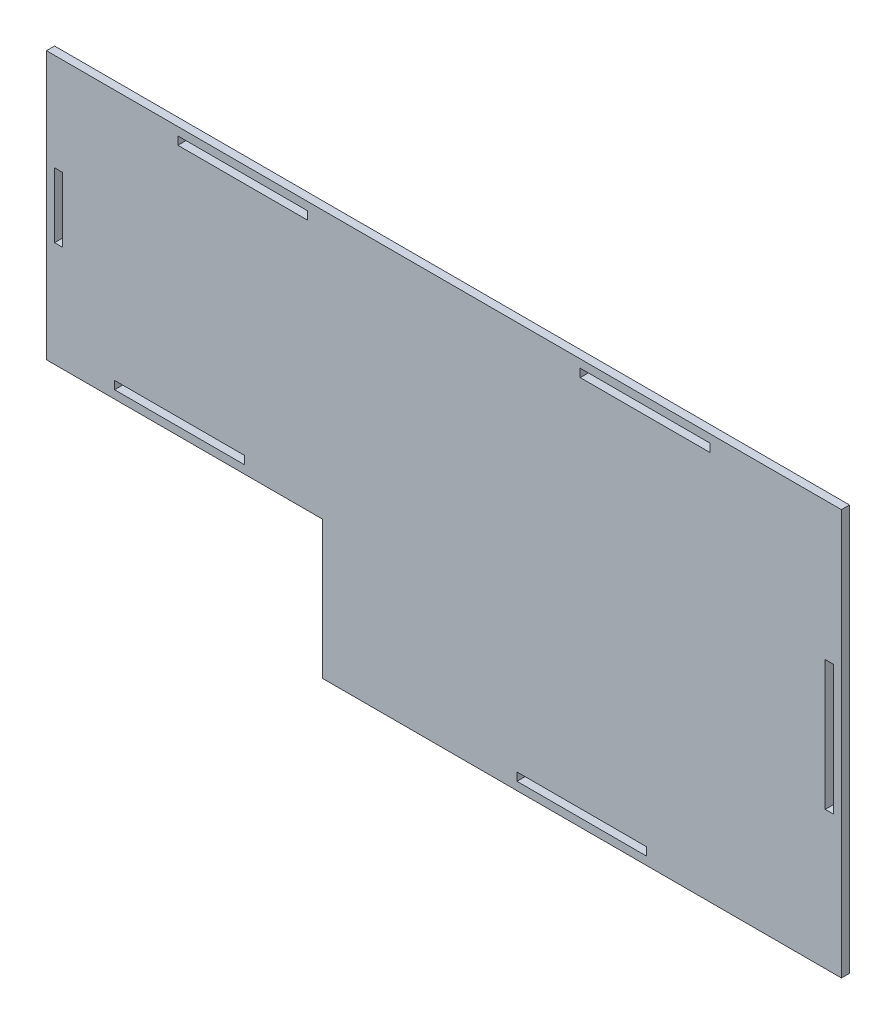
SolidWorks part; units mm, degrees
ref_plane "Front Plane" through (0, 0, 0) normal (0, 0, 1) x (1, 0, 0)
ref_plane "Top Plane" through (0, 0, 0) normal (0, 1, 0) x (1, 0, 0)
ref_plane "Right Plane" through (0, 0, 0) normal (1, 0, 0) x (0, 0, -1)
sketch "Sketch1" plane through (0, 0, 0) normal (0, 0, 1) x (1, 0, 0)
  line L0 (-87.3348, 2.7523) -> (-87.3348, -51.2227)
  line L1 (-87.3348, 2.7523) -> (-195.2848, 2.7523)
  line L2 (-87.3348, -51.2227) -> (115.8652, -51.2227)
  line L3 (-195.2848, 2.7523) -> (-195.2848, 107.5273)
  line L4 (-195.2848, 107.5273) -> (115.8652, 107.5273)
  line L5 (115.8652, 107.5273) -> (115.8652, -51.2227)
  line L7 (-168.6148, 5.9273) -> (-117.8148, 5.9273)
  line L8 (-168.6148, 5.9273) -> (-168.6148, 9.1023)
  line L9 (-168.6148, 9.1023) -> (-117.8148, 9.1023)
  line L10 (-117.8148, 5.9273) -> (-117.8148, 9.1023)
  line L11 (-192.1098, 69.4273) -> (-188.9348, 69.4273)
  line L12 (-192.1098, 69.4273) -> (-192.1098, 44.0273)
  line L13 (-192.1098, 44.0273) -> (-188.9348, 44.0273)
  line L14 (-188.9348, 69.4273) -> (-188.9348, 44.0273)
  line L15 (-11.1348, -44.8727) -> (39.6652, -44.8727)
  line L16 (-11.1348, -44.8727) -> (-11.1348, -48.0477)
  line L17 (-11.1348, -48.0477) -> (39.6652, -48.0477)
  line L18 (39.6652, -44.8727) -> (39.6652, -48.0477)
  line L19 (112.6902, 53.5523) -> (109.5152, 53.5523)
  line L20 (112.6902, 53.5523) -> (112.6902, 2.7523)
  line L21 (112.6902, 2.7523) -> (109.5152, 2.7523)
  line L22 (109.5152, 53.5523) -> (109.5152, 2.7523)
  line L23 (-143.8498, 104.3523) -> (-93.0498, 104.3523)
  line L24 (-143.8498, 104.3523) -> (-143.8498, 101.1773)
  line L25 (-143.8498, 101.1773) -> (-93.0498, 101.1773)
  line L26 (-93.0498, 104.3523) -> (-93.0498, 101.1773)
  line L27 (13.6302, 104.3523) -> (64.4302, 104.3523)
  line L28 (13.6302, 104.3523) -> (13.6302, 101.1773)
  line L29 (13.6302, 101.1773) -> (64.4302, 101.1773)
  line L30 (64.4302, 104.3523) -> (64.4302, 101.1773)
  dimension "D1" = 53.975
  dimension "D2" = 107.95
  dimension "D3" = 203.2
  dimension "D4" = 104.775
  dimension "D5" = 3.175
  dimension "D6" = 50.8
  dimension "D7" = 26.67
  dimension "D8" = 3.175
  dimension "D9" = 25.4
  dimension "D10" = 38.1
  dimension "D11" = 3.175
  dimension "D12" = 3.175
  dimension "D13" = 50.8
  dimension "D14" = 3.175
  dimension "D15" = 3.175
  dimension "D16" = 76.2
  dimension "D17" = 3.175
  dimension "D18" = 3.175
  dimension "D19" = 50.8
  dimension "D20" = 53.975
  dimension "D21" = 3.175
  dimension "D22" = 3.175
  dimension "D23" = 3.175
  dimension "D24" = 3.175
  dimension "D25" = 50.8
  dimension "D26" = 50.8
  dimension "D27" = 51.435
  dimension "D28" = 51.435
extrude "Boss-Extrude1" add sketch "Sketch1" along normal blind 3.175
